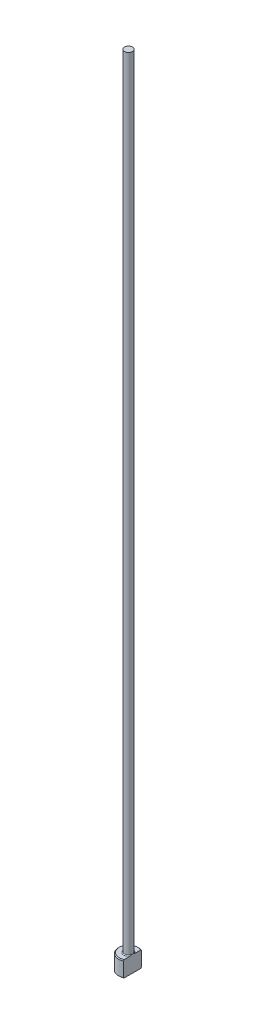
SolidWorks part; units mm, degrees
ref_plane "Front Plane" through (0, 0, 0) normal (0, 0, 1) x (1, 0, 0)
ref_plane "Top Plane" through (0, 0, 0) normal (0, 1, 0) x (1, 0, 0)
ref_plane "Right Plane" through (0, 0, 0) normal (1, 0, 0) x (0, 0, -1)
sketch "Sketch1" plane through (0, 0, 0) normal (0, 0, 1) x (1, 0, 0)
  line L0 (0, 259.9588) -> (0, -15.1925) construction
  line L1 (0, 0) -> (-2.5, 0)
  line L2 (-2.5, 0) -> (-2.5, 4)
  line L3 (-2.5, 4) -> (-1, 4)
  line L4 (-1, 4) -> (-1, 200)
  line L5 (-1, 200) -> (0, 200)
  line L6 (0, 200) -> (0, 0)
  dimension "L" = 200
  dimension "H" = 5
  dimension "T" = 4
  dimension "D" = 2
revolve "Revolve1" add sketch "Sketch1" angle 360 about L0
chamfer "Chamfer1" distance 0.2 angle 45 2 edges at (0, 4, 2.5) (0, 0, 2.5)
fillet "Fillet1" radius 0.2 1 edges at (0, 4, 1)
sketch "Sketch2" plane through (0, 0, 0) normal (0, 1, 0) x (1, 0, 0)
  line L0 (1, -2.2913) -> (1, 2.2913)
  circle A0 centre (0, 0) radius 2.5 construction
  arc A1 (1, -2.2913) -> (1, 2.2913) centre (0, 0) ccw
  circle A2 centre (0, 0) radius 1 construction
extrude "KEYED HEAD" cut sketch "Sketch2" along normal through all
